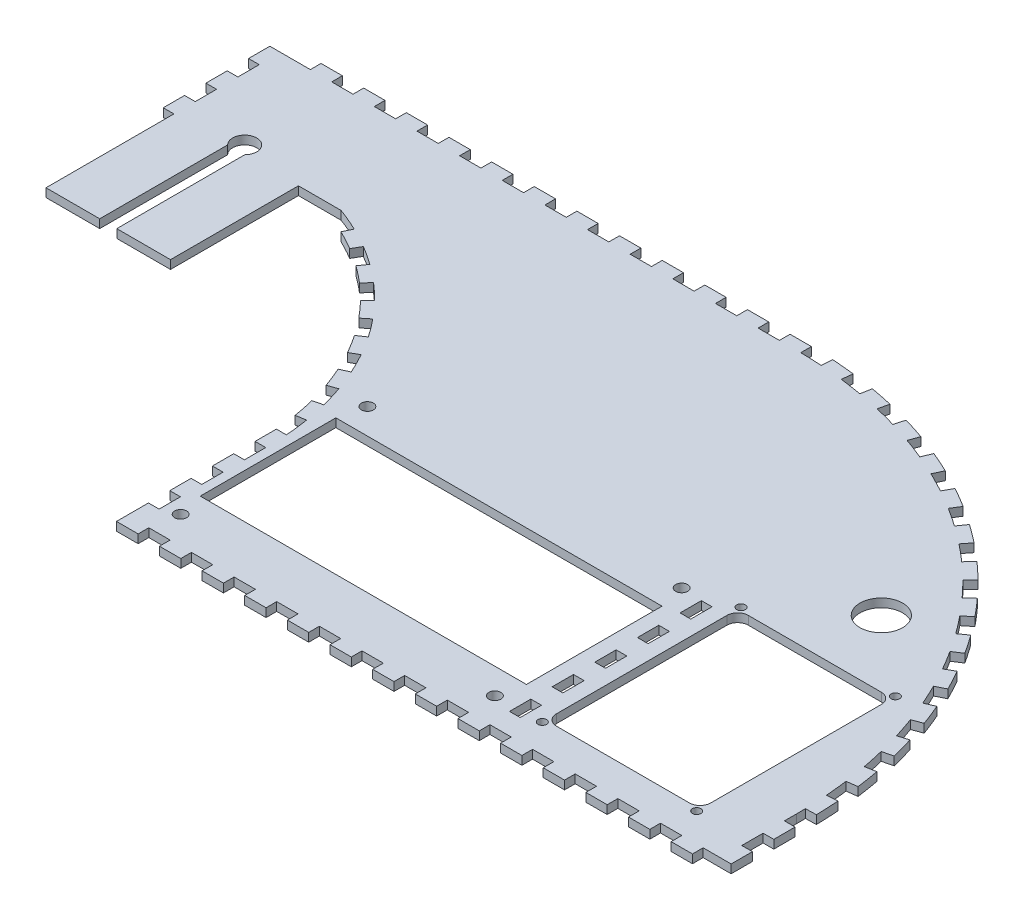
SolidWorks part; units mm, degrees
ref_plane "Front Plane" through (0, 0, 0) normal (0, 0, 1) x (1, 0, 0)
ref_plane "Top Plane" through (0, 0, 0) normal (0, 1, 0) x (1, 0, 0)
ref_plane "Right Plane" through (0, 0, 0) normal (1, 0, 0) x (0, 0, -1)
sketch "Sketch1" plane through (0, 0, 0) normal (0, 1, 0) x (1, 0, 0)
  line L0 (254.7316, -26.8627) -> (254.7316, -49.4898)
  line L1 (18.542, 22.8981) -> (-18.542, 22.8981)
  line L2 (-18.542, 60.9981) -> (-18.542, 92.7481)
  line L3 (18.542, 22.8981) -> (18.542, 60.9981)
  line L4 (-18.542, 22.8981) -> (-18.542, 60.9981)
  line L5 (241.5697, -49.4898) -> (254.7316, -49.4898)
  line L6 (81.1888, -10.5366) -> (81.1888, -49.4898)
  line L7 (18.542, 60.9981) -> (31.242, 60.9981)
  line L8 (-18.542, 92.7481) -> (43.942, 92.7481)
  line L9 (43.942, 92.7481) -> (135.1208, 92.7481)
  line L10 (89.2235, -49.4898) -> (81.1888, -49.4898)
  line L12 (89.2235, -49.4898) -> (241.5697, -49.4898)
  arc A3 (31.242, 60.9981) -> (81.1888, -10.5366) centre (4.9888, -10.5366) cw
  arc A6 (254.7316, -26.8627) -> (135.1208, 92.7481) centre (135.1208, -26.8627) ccw
  dimension "D1" = 76.2
  dimension "D4" = 38.1
  dimension "D5" = 12.7
extrude "main shape" add sketch "Sketch1" along normal blind 2.54
sketch "Sketch13" plane through (0, 2.54, 0) normal (0, 1, 0) x (1, 0, 0)
  line L0 (18.542, 22.8981) -> (-18.542, 22.8981)
  line L1 (18.542, 22.8981) -> (-18.542, 22.8981) construction
  line L5 (-2.54, 22.8981) -> (-2.54, 60.9981)
  line L6 (2.54, 22.8981) -> (2.54, 60.9981)
  arc A1 (-2.54, 60.9981) -> (2.54, 60.9981) centre (0, 63.5381) cw
extrude "wire slot" cut sketch "Sketch13" against normal up to surface (2.54 mm away) contours A1 L5 L0 L6
sketch "Sketch17" plane through (0, 2.54, 0) normal (0, 1, 0) x (1, 0, 0)
  line L0 (83.9662, -13.4768) -> (181.1212, -13.4768) construction
  line L1 (83.9662, 6.7162) -> (181.1212, 6.7162)
  line L2 (83.9662, 6.7162) -> (83.9662, -33.6698)
  line L3 (83.9662, -33.6698) -> (181.1212, -33.6698)
  line L4 (181.1212, 6.7162) -> (181.1212, -33.6698)
  line L5 (83.9662, -13.4768) -> (83.9662, 14.3362) construction
  line L6 (83.9662, 14.3362) -> (85.7442, 14.3362) construction
  line L7 (83.9662, -13.4768) -> (83.9662, -41.2898) construction
  line L8 (83.9662, -41.2898) -> (85.7442, -41.2898) construction
  line L9 (181.1212, -13.4768) -> (181.1212, 14.3362) construction
  line L10 (181.1212, 14.3362) -> (179.3432, 14.3362) construction
  line L11 (181.1212, -13.4768) -> (181.1212, -41.2898) construction
  line L12 (181.1212, -41.2898) -> (179.3432, -41.2898) construction
  line L13 (216.1466, 17.1852) -> (216.1466, -39.9648) construction
  line L14 (193.1596, 17.1852) -> (239.1336, 17.1852)
  line L15 (193.1596, 17.1852) -> (193.1596, -39.9648)
  line L16 (193.1596, -39.9648) -> (239.1336, -39.9648)
  line L17 (239.1336, 17.1852) -> (239.1336, -39.9648)
  line L18 (193.1596, -11.3898) -> (239.1336, -11.3898) construction
  line L19 (239.1336, -11.3898) -> (239.1336, 18.2012) construction
  line L21 (239.1336, -11.3898) -> (239.1336, -40.9808) construction
  line L23 (193.1596, -11.3898) -> (193.1596, 18.2012) construction
  line L25 (193.1596, -11.3898) -> (193.1596, -40.9808) construction
  line L27 (181.1212, 6.7162) -> (193.1596, 6.7162) construction
  line L28 (187.1404, 6.7162) -> (187.1404, -49.4898) construction
  line L29 (81.1888, -49.4898) -> (254.7316, -49.4898) construction
  line L30 (185.5529, -43.1398) -> (185.5529, -36.7898)
  line L31 (185.5529, -43.1398) -> (188.7279, -43.1398)
  line L32 (185.5529, -36.7898) -> (188.7279, -36.7898)
  line L33 (188.7279, -43.1398) -> (188.7279, -36.7898)
  line L34 (185.5529, -43.1398) -> (188.7279, -36.7898) construction
  line L35 (185.5529, -36.7898) -> (188.7279, -43.1398) construction
  line L36 (185.5529, -24.0898) -> (188.7279, -24.0898)
  line L37 (188.7279, -30.4398) -> (188.7279, -24.0898)
  line L38 (185.5529, -30.4398) -> (188.7279, -30.4398)
  line L39 (185.5529, -30.4398) -> (185.5529, -24.0898)
  line L40 (187.1404, 19.4162) -> (187.1404, -36.7898) construction
  line L41 (185.5529, -11.3898) -> (188.7279, -11.3898)
  line L42 (188.7279, -17.7398) -> (188.7279, -11.3898)
  line L43 (185.5529, -17.7398) -> (188.7279, -17.7398)
  line L44 (185.5529, -17.7398) -> (185.5529, -11.3898)
  line L45 (187.1404, 32.1162) -> (187.1404, -24.0898) construction
  line L46 (185.5529, 1.3102) -> (188.7279, 1.3102)
  line L47 (188.7279, -5.0398) -> (188.7279, 1.3102)
  line L48 (185.5529, -5.0398) -> (188.7279, -5.0398)
  line L49 (185.5529, -5.0398) -> (185.5529, 1.3102)
  line L50 (187.1404, 44.8162) -> (187.1404, -11.3898) construction
  line L51 (185.5529, 14.0102) -> (188.7279, 14.0102)
  line L52 (188.7279, 7.6602) -> (188.7279, 14.0102)
  line L53 (185.5529, 7.6602) -> (188.7279, 7.6602)
  line L54 (185.5529, 7.6602) -> (185.5529, 14.0102)
  line L55 (187.1404, 57.5162) -> (187.1404, 1.3102) construction
  line L56 (196.3346, -39.9648) -> (196.3346, 17.1852) construction
  line L57 (193.1596, 14.0102) -> (239.1336, 14.0102) construction
  line L58 (235.9586, 17.1852) -> (235.9586, -39.9648) construction
  line L59 (193.1596, -36.7898) -> (239.1336, -36.7898) construction
  circle A0 centre (85.7442, 14.3362) radius 1.778
  circle A1 centre (179.3432, 14.3362) radius 1.778
  circle A2 centre (179.3432, -41.2898) radius 1.778
  circle A3 centre (85.7442, -41.2898) radius 1.778
  circle A4 centre (193.1596, 18.2012) radius 1.27
  arc A5 (193.1596, -36.7898) -> (196.3346, -39.9648) centre (196.3346, -36.7898) ccw
  arc A6 (193.1596, 14.0102) -> (196.3346, 17.1852) centre (196.3346, 14.0102) cw
  arc A7 (239.1336, 14.0102) -> (235.9586, 17.1852) centre (235.9586, 14.0102) ccw
  arc A8 (235.9586, -39.9648) -> (239.1336, -36.7898) centre (235.9586, -36.7898) ccw
  circle A9 centre (239.1336, 18.2012) radius 1.27
  circle A10 centre (239.1336, -40.9808) radius 1.27
  circle A11 centre (193.1596, -40.9808) radius 1.27
  circle A12 centre (216.1466, 37.0059) radius 6.35
  point P44 (187.1404, -39.9648)
  dimension "D1" = 97.155
  dimension "D2" = 40.386
  dimension "D3" = 27.813
  dimension "D4" = 1.778
  dimension "D5" = 27.813
  dimension "D6" = 1.778
  dimension "D7" = 27.813
  dimension "D8" = 27.813
  dimension "D9" = 1.778
  dimension "D10" = 1.778
  dimension "D11" = 45.974
  dimension "D12" = 57.15
  dimension "D13" = 29.591
  dimension "D15" = 29.591
  dimension "D16" = 29.591
  dimension "D17" = 29.591
  dimension "D21" = 3.175
  dimension "D22" = 1.5875
  dimension "D23" = 6.35
  dimension "D24" = 6.35
  dimension "D26" = 3.175
  dimension "D27" = 3.175
  dimension "D28" = 3.175
  dimension "D29" = 3.175
  dimension "D25" = 5
extrude "display and controls" cut sketch "Sketch17" against normal blind 3.175 contours L16 A8 L17 A7 L14 A6 L15 A5 | L44 L43 L42 L41 | L49 L48 L47 L46 | L4 L1 L2 L3 | A2 | A0 | A12
sketch "Sketch19" plane through (0, 2.54, 0) normal (0, 1, 0) x (1, 0, 0)
  line L1 (-18.542, 92.7481) -> (-21.717, 92.7481)
  line L2 (-18.542, 92.7481) -> (-18.542, 86.3981)
  line L3 (-18.542, 86.3981) -> (-21.717, 86.3981)
  line L4 (-21.717, 92.7481) -> (-21.717, 86.3981)
  dimension "D1" = 3.175
  dimension "D2" = 6.35
extrude "teeth near back" add sketch "Sketch19" against normal up to surface (2.54 mm away)
pattern_linear "LPattern1" count 3 spacing 12.7 along (0, 0, 1) of "teeth near back"
sketch "Sketch20" plane through (0, 2.54, 0) normal (0, 1, 0) x (1, 0, 0)
  line L1 (254.7316, -49.4898) -> (257.9066, -49.4898)
  line L2 (254.7316, -49.4898) -> (254.7316, -43.1398)
  line L3 (254.7316, -43.1398) -> (257.9066, -43.1398)
  line L4 (257.9066, -49.4898) -> (257.9066, -43.1398)
  dimension "D1" = 3.175
  dimension "D2" = 6.35
extrude "teeth short exterior" add sketch "Sketch20" against normal up to surface (2.54 mm away)
pattern_linear "LPattern2" count 2 spacing 12.7 along (0, 0, -1) of "teeth short exterior"
sketch "Sketch21" plane through (0, 2.54, 0) normal (0, 1, 0) x (1, 0, 0)
  line L0 (257.9066, -30.4398) -> (257.9066, -24.0898)
  line L1 (257.9066, -24.0898) -> (135.1208, -26.8627)
  line L2 (257.5687, -17.3469) -> (135.1208, -26.8627)
  line L3 (256.8608, -10.6327) -> (135.1208, -26.8627)
  line L4 (255.785, -3.9676) -> (135.1208, -26.8627)
  line L5 (254.3446, 2.6283) -> (135.1208, -26.8627)
  line L6 (252.5439, 9.1351) -> (135.1208, -26.8627)
  line L7 (250.3884, 15.5332) -> (135.1208, -26.8627)
  line L8 (247.8846, 21.8031) -> (135.1208, -26.8627)
  line L9 (245.04, 27.926) -> (135.1208, -26.8627)
  line L10 (241.8633, 33.8833) -> (135.1208, -26.8627)
  line L11 (238.364, 39.657) -> (135.1208, -26.8627)
  line L12 (234.5528, 45.2297) -> (135.1208, -26.8627)
  line L13 (230.441, 50.5846) -> (135.1208, -26.8627)
  line L14 (226.0413, 55.7055) -> (135.1208, -26.8627)
  line L15 (221.3668, 60.5768) -> (135.1208, -26.8627)
  line L16 (216.4316, 65.1839) -> (135.1208, -26.8627)
  line L17 (211.2508, 69.5129) -> (135.1208, -26.8627)
  line L18 (205.8399, 73.5506) -> (135.1208, -26.8627)
  line L19 (200.2154, 77.2849) -> (135.1208, -26.8627)
  line L20 (194.3941, 80.7045) -> (135.1208, -26.8627)
  line L21 (188.3937, 83.7991) -> (135.1208, -26.8627)
  line L22 (182.2323, 86.5593) -> (135.1208, -26.8627)
  line L23 (175.9286, 88.9767) -> (135.1208, -26.8627)
  line L24 (169.5015, 91.044) -> (135.1208, -26.8627)
  line L25 (162.9706, 92.7551) -> (135.1208, -26.8627)
  line L26 (156.3555, 94.1047) -> (135.1208, -26.8627)
  line L27 (149.6762, 95.0888) -> (135.1208, -26.8627)
  line L28 (142.953, 95.7044) -> (135.1208, -26.8627)
  line L29 (136.206, 95.9496) -> (135.1208, -26.8627)
  arc A0 (257.9066, -24.0898) -> (136.206, 95.9496) centre (135.1208, -26.8627) ccw
  arc A1 (252.5439, -24.2109) -> (136.1586, 90.5858) centre (135.1208, -26.8627) ccw
  point P37 (135.1208, -26.8627)
  dimension "D1" = 29
extrude "teeth exterior curve" add sketch "Sketch21" against normal up to surface (2.54 mm away) contours A1 L1 A0 L2 | A1 L3 A0 L4 | A1 L5 A0 L6 | A1 L7 A0 L8 | A1 L9 A0 L10 | A1 L11 A0 L12 | A1 L13 A0 L14 | A1 L15 A0 L16 | A1 L17 A0 L18 | A1 L19 A0 L20 | A1 L21 A0 L22 | A1 L23 A0 L24 | A1 L25 A0 L26 | A1 L27 A0 L28
sketch "Sketch22" plane through (0, 2.54, 0) normal (0, 1, 0) x (1, 0, 0)
  line L0 (142.7485, 92.5046) -> (136.3985, 92.5046)
  line L1 (136.3985, 92.5046) -> (136.3985, 95.9231)
  line L2 (136.3985, 95.9231) -> (130.0485, 95.9231)
  line L3 (130.0485, 95.9231) -> (130.0485, 92.7481)
  line L4 (-21.717, 92.7481) -> (135.1208, 92.7481) construction
  line L5 (136.3985, 92.5046) -> (130.0485, 92.7481)
  dimension "D1" = 3.175
  dimension "D2" = 6.35
  dimension "D3" = 6.35
extrude "teeth across back" add sketch "Sketch22" against normal up to surface (2.54 mm away) contours L1 L2 L3 L5
pattern_linear "LPattern3" count 12 spacing 12.7 along (-1, 0, 0) of "teeth across back"
sketch "Sketch23" plane through (0, 2.54, 0) normal (0, 1, 0) x (1, 0, 0)
  line L1 (81.1888, -49.4898) -> (78.0138, -49.4898)
  line L2 (81.1888, -49.4898) -> (81.1888, -43.1398)
  line L3 (81.1888, -43.1398) -> (78.0138, -43.1398)
  line L4 (78.0138, -49.4898) -> (78.0138, -43.1398)
  dimension "D1" = 3.175
  dimension "D2" = 6.35
extrude "teeth short interior" add sketch "Sketch23" against normal up to surface (2.54 mm away)
pattern_linear "LPattern4" count 4 spacing 12.7 along (0, 0, -1) of "teeth short interior"
sketch "Sketch24" plane through (0, 2.54, 0) normal (0, 1, 0) x (1, 0, 0)
  line L0 (4.9888, -10.5366) -> (80.2522, 1.7946)
  line L1 (4.9888, -10.5366) -> (78.891, 8.3073)
  line L2 (78.0138, -5.0398) -> (81.4715, -5.0398)
  line L3 (81.4715, -5.0398) -> (80.9739, -4.817)
  line L4 (4.9888, -10.5366) -> (80.9739, -4.817)
  line L5 (80.9739, -4.817) -> (81.0383, -4.7824)
  line L6 (4.9888, -10.5366) -> (76.9674, 14.6766)
  line L7 (4.9888, -10.5366) -> (74.4961, 20.854)
  line L8 (4.9888, -10.5366) -> (71.4957, 26.7925)
  line L9 (4.9888, -10.5366) -> (67.9892, 32.4469)
  line L10 (4.9888, -10.5366) -> (64.0032, 37.7742)
  line L11 (4.9888, -10.5366) -> (59.568, 42.7338)
  line L12 (4.9888, -10.5366) -> (54.7175, 47.288)
  line L13 (4.9888, -10.5366) -> (49.4886, 51.4021)
  line L14 (4.9888, -10.5366) -> (43.9209, 55.0448)
  line L15 (4.9888, -10.5366) -> (38.057, 58.1884)
  arc A0 (80.9903, -5.0398) -> (31.242, 60.9981) centre (4.9888, -10.5366) ccw construction
  arc A1 (78.0138, -5.0398) -> (36.7409, 55.4533) centre (4.9888, -10.5366) ccw
  arc A2 (81.0383, -4.7824) -> (32.3037, 60.671) centre (4.9888, -10.5366) ccw
  point P25 (4.9888, -10.5366)
  dimension "D2" = 60
  dimension "D1" = 13
extrude "teeth interior curve" add sketch "Sketch24" against normal up to surface (2.54 mm away) contours L0 A2 L1 A1 | L6 A2 L7 A1 | L8 A2 L9 A1 | L10 A2 L11 A1 | L12 A2 L13 A1 | L14 A2 L15 A1
sketch "Sketch25" plane through (0, 2.54, 0) normal (0, 1, 0) x (1, 0, 0)
  line L1 (78.0138, -49.4898) -> (84.4654, -49.4898)
  line L2 (78.0138, -49.4898) -> (78.0138, -52.6648)
  line L3 (78.0138, -52.6648) -> (84.4654, -52.6648)
  line L4 (84.4654, -49.4898) -> (84.4654, -52.6648)
  dimension "D1" = 3.175
  dimension "D2" = 6.4516
extrude "teeth corner snaggletooth" add sketch "Sketch25" against normal up to surface (2.54 mm away)
sketch "Sketch26" plane through (0, 2.54, 0) normal (0, 1, 0) x (1, 0, 0)
  line L0 (257.9066, -49.4898) -> (84.4654, -49.4898) construction
  line L1 (90.8154, -49.4898) -> (97.1654, -49.4898)
  line L2 (90.8154, -49.4898) -> (90.8154, -52.6648)
  line L3 (90.8154, -52.6648) -> (97.1654, -52.6648)
  line L4 (97.1654, -49.4898) -> (97.1654, -52.6648)
  line L5 (84.4654, -52.6648) -> (84.4654, -49.4898) construction
  dimension "D1" = 3.175
  dimension "D2" = 6.35
  dimension "D3" = 6.35
extrude "teeth across front" add sketch "Sketch26" against normal up to surface (2.54 mm away)
pattern_linear "LPattern5" count 13 spacing 12.7 along (1, 0, 0) of "teeth across front"
